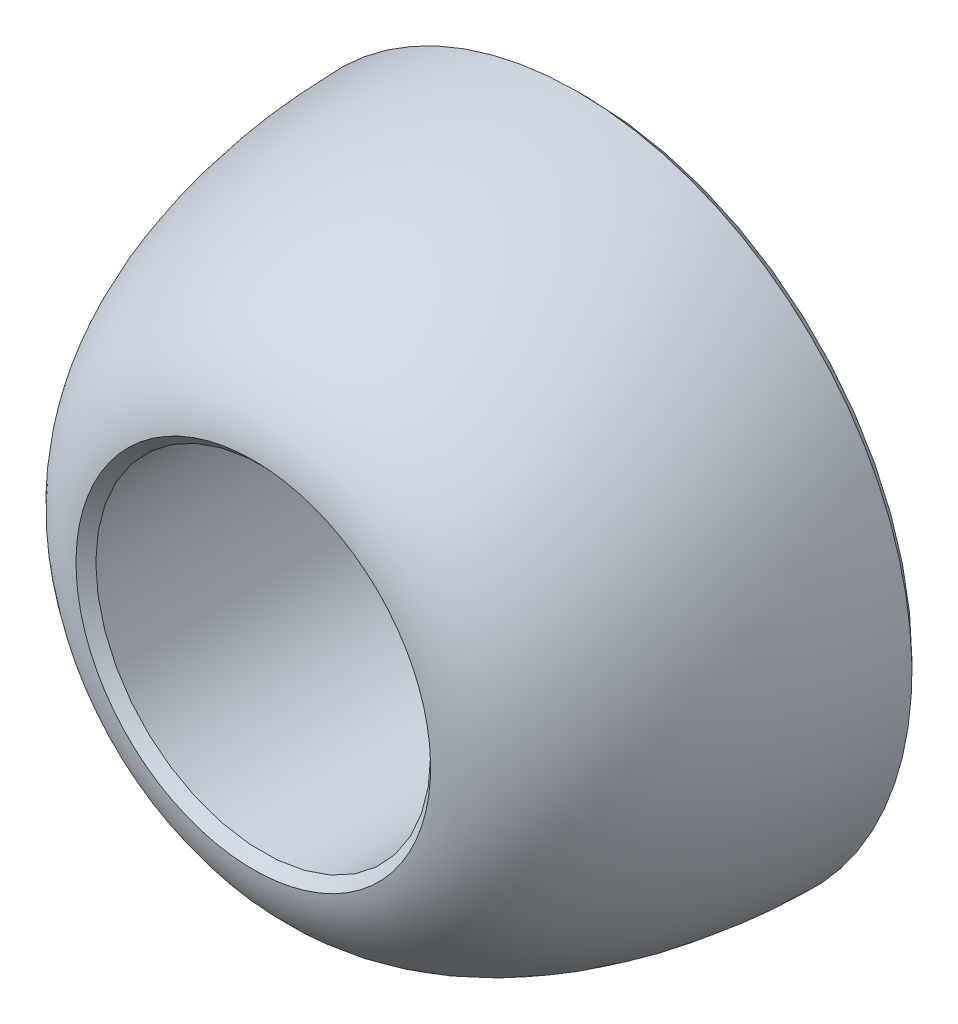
SolidWorks part; units mm, degrees
ref_plane "Спереди" through (0, 0, 0) normal (0, 0, 1) x (1, 0, 0)
ref_plane "Сверху" through (0, 0, 0) normal (0, 1, 0) x (1, 0, 0)
ref_plane "Справа" through (0, 0, 0) normal (1, 0, 0) x (0, 0, -1)
sketch "Эскиз1" plane through (0, 0, 0) normal (1, 0, 0) x (0, 0, -1)
  line L0 (-4, 0) -> (4, 0) construction
  line L1 (-4, 4) -> (4, 4)
  line L2 (4, 4) -> (4, 8)
  ellipse E0 centre (4, 4) end of major axis (-4, 4) minor radius 4 (4, 8) -> (-4, 4) ccw
  dimension "D1" = 8
  dimension "D2" = 8
  dimension "D3" = 16
revolve "Повернуть1" add sketch "Эскиз1" angle 360 about L0
chamfer "Фаска1" distance 0.25 angle 45 3 edges at (4, 0, 4) (4, 0, -4) (8, 0, -4)
